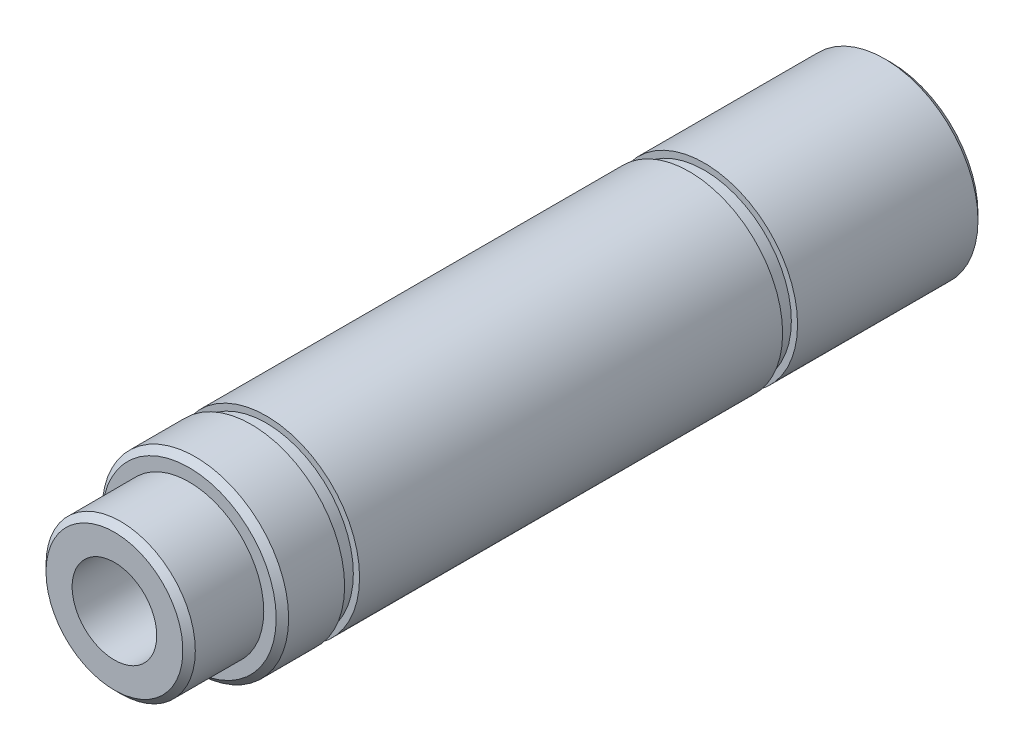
SolidWorks part; units mm, degrees
ref_plane "Front Plane" through (0, 0, 0) normal (0, 0, 1) x (1, 0, 0)
ref_plane "Top Plane" through (0, 0, 0) normal (0, 1, 0) x (1, 0, 0)
ref_plane "Right Plane" through (0, 0, 0) normal (1, 0, 0) x (0, 0, -1)
sketch "Sketch1" plane through (0, 0, 0) normal (1, 0, 0) x (0, 0, -1)
  line L0 (-31.2, 6) -> (-31.2, 0)
  line L1 (-20.2, 7.5) -> (-25.2, 7.5)
  line L2 (-20.2, 7.5) -> (-20.2, 7)
  line L3 (-20.2, 7) -> (-19, 7)
  line L4 (-19, 7) -> (-19, 7.5)
  line L5 (-19, 7.5) -> (15, 7.5)
  line L6 (15, 7.5) -> (15, 7)
  line L7 (15, 7) -> (16.2, 7)
  line L8 (16.2, 7) -> (16.2, 7.5)
  line L9 (16.2, 7.5) -> (31.2, 7.5)
  line L10 (31.2, 7.5) -> (31.2, 0)
  line L11 (-47.7128, 0) -> (45.6383, 0) construction
  line L12 (-31.2, 0) -> (31.2, 0)
  line L13 (-25.2, 7.5) -> (-25.2, 6)
  line L14 (-25.2, 6) -> (-31.2, 6)
  point P1 (0, 0)
  point P15 (16.2, 7.25)
  dimension "D2" = 34
  dimension "D3" = 12
  dimension "D4" = 15
  dimension "D5" = 14
  dimension "D6" = 14
  dimension "D7" = 15
  dimension "D8" = 15
  dimension "D9" = 1.2
  dimension "D10" = 1.2
  dimension "D11" = 15
  dimension "D12" = 5
  dimension "D13" = 6
revolve "Revolve1" add sketch "Sketch1" angle 360 about L11
sketch "Sketch3" plane through (0, 0, 31.2) normal (0, 0, 1) x (1, 0, 0)
  point P0 (0, 0)
hole_wizard "M8 Tapped Hole1" positions "3DSketch1" profile "Sketch4" tap size "M8" standard "ISO"
sketch3d "3DSketch1"
  point P0 (0, 0, 31.2)
sketch "Sketch4" plane through (0, 0, 31.2) normal (1, 0, 0) x (0, -1, 0)
  line L0 (0, 0) -> (0, 32.0429)
  line L1 (0, 32.0429) -> (3.4, 30)
  line L2 (3.4, 30) -> (3.4, 0)
  line L5 (3.4, 0) -> (0, 0)
  line L10 (0, 32.0429) -> (-3.4, 30) construction
  line L11 (0, -6.35) -> (0, 107.95) construction
  dimension "Tap Drill Dia." = 6.8
  dimension "Tap Drill Depth" = 30
  dimension "Drill Angle" = 118
chamfer "Chamfer1" distance 0.5 angle 45 3 edges at (7.5, 0, -31.2) (7.5, 0, 25.2) (6, 0, 31.2)
